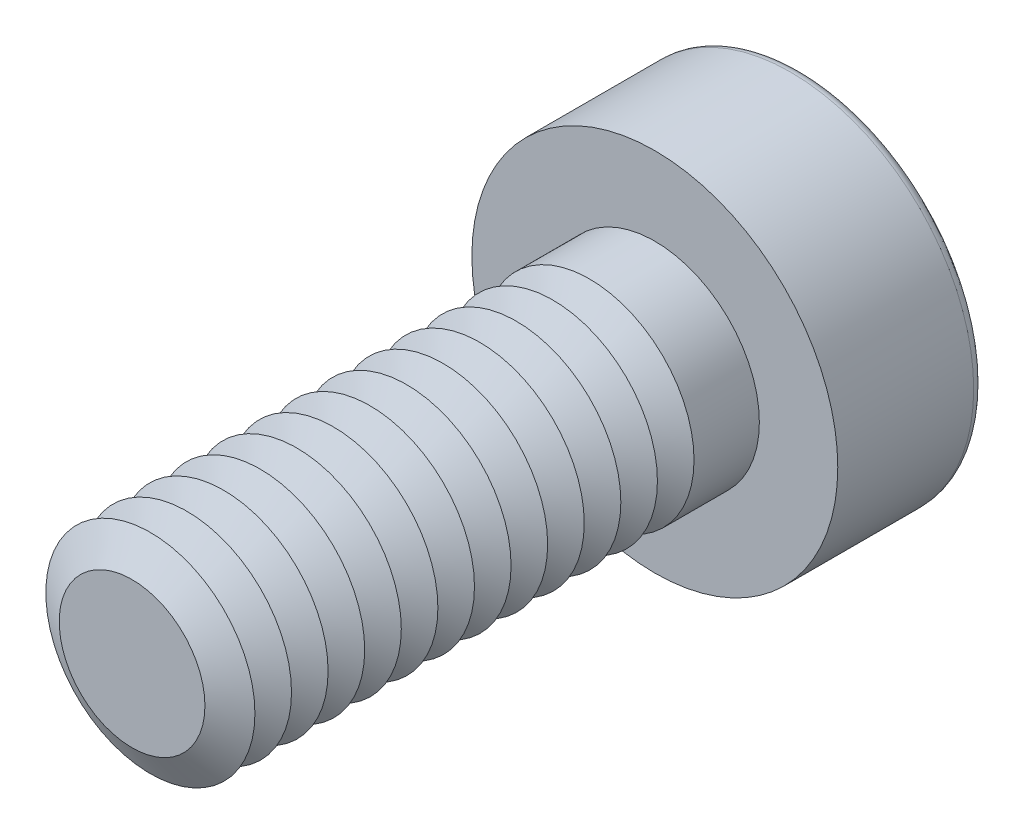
SolidWorks part; units mm, degrees
ref_plane "Front Plane" through (0, 0, 0) normal (0, 0, 1) x (1, 0, 0)
ref_plane "Top Plane" through (0, 0, 0) normal (0, 1, 0) x (1, 0, 0)
ref_plane "Right Plane" through (0, 0, 0) normal (1, 0, 0) x (0, 0, -1)
sketch "Sketch1" plane through (0, 0, 0) normal (0, 0, 1) x (1, 0, 0)
  circle A0 centre (0, 0) radius 2
  dimension "D1" = 4
extrude "Boss-Extrude1" add sketch "Sketch1" along normal blind 10
sketch "Sketch2" plane through (0, 0, 0) normal (0, 0, -1) x (-1, 0, 0)
  circle A0 centre (0, 0) radius 3.5
  dimension "D1" = 7
extrude "Boss-Extrude2" add sketch "Sketch2" along normal blind 2.8
sketch "Sketch3" plane through (0, 0, -2.8) normal (0, 0, -1) x (-1, 0, 0)
  line L1 (-0.7217, 1.25) -> (-1.4434, 0)
  line L2 (-1.4434, 0) -> (-0.7217, -1.25)
  line L3 (-0.7217, -1.25) -> (0.7217, -1.25)
  line L4 (0.7217, -1.25) -> (1.4434, 0)
  line L5 (1.4434, 0) -> (0.7217, 1.25)
  line L6 (0.7217, 1.25) -> (-0.7217, 1.25)
  circle A0 centre (0, 0) radius 1.25 construction
  dimension "D1" = 2.5
extrude "Cut-Extrude1" cut sketch "Sketch3" against normal blind 1.875
fillet "Fillet1" radius 0.2 1 edges at (-3.5, 0, -2.8)
sketch "Sketch4" plane through (0, 0, -0.925) normal (0, 0, -1) x (-1, 0, 0)
  line L0 (0.7217, -1.25) -> (1.4434, 0) construction
  circle A0 centre (0, 0) radius 1.25
extrude "Cut-Extrude2" cut sketch "Sketch4" against normal through all draft 60
sketch "Sketch5" plane through (0, 0, -2.8) normal (0, 0, -1) x (-1, 0, 0)
  circle A0 centre (0, 0) radius 1.4434
extrude "Cut-Extrude3" cut sketch "Sketch5" against normal through all draft 75
sketch "Sketch7" plane through (0, 0, 0) normal (1, 0, 0) x (0, 0, -1)
  line L25 (-10, 1.3938) -> (-9.65, 2)
  line L26 (-10, 2) -> (-10, -2) construction
  line L27 (-9.65, 2) -> (-10.35, 2)
  line L28 (-10.35, 2) -> (-10, 1.3938)
  line L29 (0, 2) -> (-10, 2) construction
  dimension "D1" = 0.7
revolve "Cut-Revolve1" cut sketch "Sketch7" angle 360 about axis through (0, 0, 10) along (0, 0, -1)
pattern_linear "LPattern1" count 13 spacing 0.7 along (0, 0, -1) of "Cut-Revolve1"
